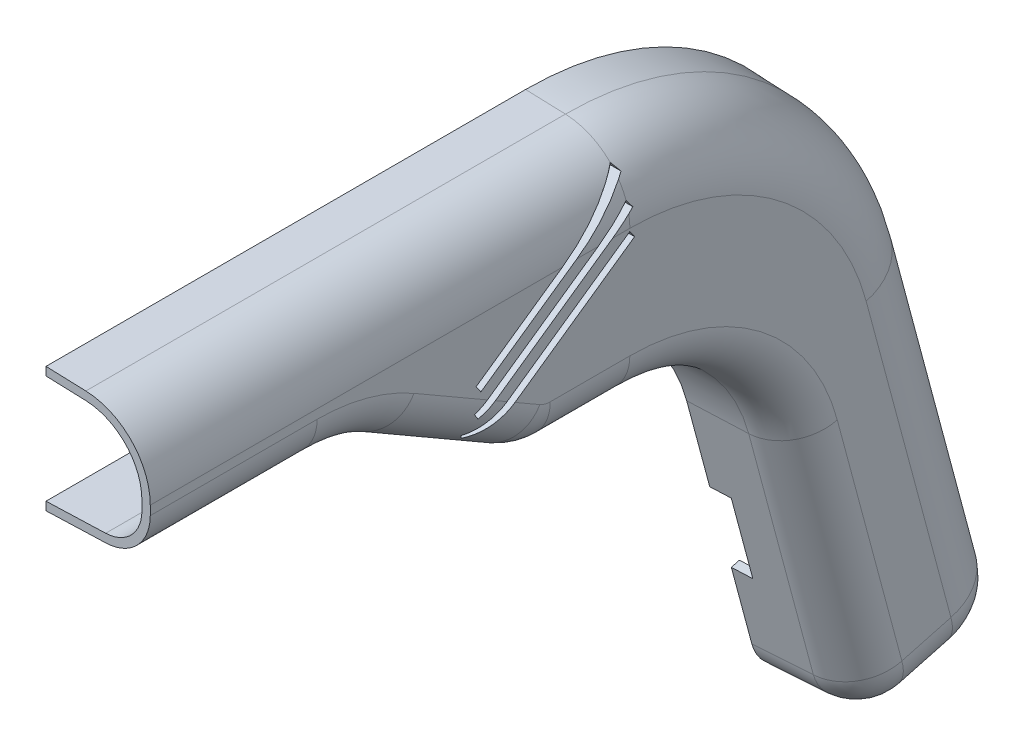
SolidWorks part; units mm, degrees
ref_plane "Front" through (0, 0, 0) normal (0, 0, 1) x (1, 0, 0)
ref_plane "Top" through (0, 0, 0) normal (0, 1, 0) x (1, 0, 0)
ref_plane "Right" through (0, 0, 0) normal (1, 0, 0) x (0, 0, -1)
sketch "Sketch1" plane through (0, 0, 0) normal (1, 0, 0) x (0, 0, -1)
  line L0 (-115, 75) -> (0, 75)
  line L1 (72.4444, 19.4114) -> (95.7382, -67.5219)
  line L2 (95.7382, -67.5219) -> (57.1011, -77.8747)
  line L3 (57.1011, -77.8747) -> (38.637, -8.9658)
  line L4 (0, 20.6815) -> (-23.5009, 20.6815)
  line L5 (-23.5009, 20.6815) -> (-57.5, 40.3109)
  line L6 (-75, 45) -> (-115, 45)
  line L7 (-115, 45) -> (-115, 75)
  line L8 (0, 0) -> (0, -19.3185) construction
  arc A0 (0, 75) -> (72.4444, 19.4114) centre (0, 0) cw
  arc A1 (38.637, -8.9658) -> (0, 20.6815) centre (0, -19.3185) ccw
  arc A2 (-57.5, 40.3109) -> (-75, 45) centre (-75, 10) ccw
  dimension "D1" = 75
  dimension "D5" = 40
  dimension "D8" = 35
  dimension "D2" = 105
  dimension "D3" = 40
  dimension "D4" = 90
  dimension "D6" = 30
  dimension "D7" = 115
  dimension "D9" = 150
  dimension "D10" = 40
extrude "Base-Extrude" add sketch "Sketch1" along normal blind 25
draft "Draft1" type of draft neutral plane draft angle 2 faces to draft 10 parameters "D1"=2
fillet "Fillet1" radius 16 4 edges at (12.5, 21.118, 23.3839) (25, -23.8596, -83.135) (25, 58.8089, -45.1256) (25, 74.127, 57.5)
fillet "Fillet2" radius 11 1 edges at (12.5, -77.34, -57.4098)
fillet "Fillet3" radius 11 11 edges at (25, 44.6507, 65.7154) (25, 32.3819, 42.0205) (25, 13.1082, -24.8819) (25, -37.4633, -47.1767) (25, 21.5545, 9.4912) (25, 22.0993, 23.121) (4.7792, -67.4039, -95.5337) (20.5094, -68.1784, -90.5208) (25, -72.4319, -74.0408) (25, -72.8629, -59.9946) (25, 45.873, 95)
shell "Shell1" thickness 2
ref_plane "Plane1" through (3, 0, 0) normal (-1, 0, 0) x (0, 0, 1)
sketch "Sketch2" plane through (3, 0, 0) normal (-1, 0, 0) x (0, 0, 1)
  line L0 (-10, 27.0009) -> (-10, 67.9199)
  line L1 (40, 36.8882) -> (40, 67.9199)
  line L2 (115, 47.5011) -> (115, 56.4956) construction
  dimension "D1" = 125
  dimension "D2" = 50
rib "Rib1" sketch "Sketch2" sketch "Sketch2" thickness 2 extrusion direction normal to sketch draft on yes draft angle 3 parameters "D1"=2, "D3"=3
ref_plane "Plane2" through (3, 0, 0) normal (-1, 0, 0) x (0, 0, 1)
sketch "Sketch3" plane through (3, 0, 0) normal (-1, 0, 0) x (0, 0, 1)
  line L0 (-92.8929, -56.9032) -> (-72.4444, 19.4114) construction
  line L1 (-67.7198, -75.0294) -> (-85.1194, -70.3672) construction
  circle A0 centre (-86.6981, -49.2387) radius 2.5
  dimension "D1" = 4
  dimension "D2" = 5
  dimension "D3" = 20
extrude "Boss-Extrude1" add sketch "Sketch3" against normal up to next draft 2
fillet "Fillet4" radius 1 31 edges at (19.8277, 24.5742, -8.1181) (19.69, 23.5912, -11.8747) (19.0643, 67.9197, -8.1581) (18.5216, 67.9197, -11.8135) (3, 72.2047, -10.001) (6.2464, 72.243, -8.8299) (8.6485, 21.4487, -11.296) (23, 44.0868, -12.0482) (3, 46.6922, -11) (23, 44.847, -7.9518) (3, 21.582, -10.003) (3, 47.0753, -9) (6.2475, 71.9183, -11.1702) (8.639, 22.0792, -8.7045) (20.4741, 37.3682, 41.9158) (20.4741, 35.1561, 38.0842) (19.0708, 68.4012, 41.8422) (19.0708, 68.4012, 38.1578) (3, 72.894, 40) (6.2443, 72.7807, 41.17) (8.657, 32.1186, 38.7035) (23, 50.4873, 37.9518) (3, 52.4779, 39) (23, 51.6698, 42.0482) (3, 32.639, 40) (3, 53.0552, 41) (6.2443, 72.7807, 38.83) (8.657, 33.6157, 41.2965) (19.5089, -49.9156, -83.697) (4.2388, -50.4446, -88.9372) (7.8117, -46.8267, -87.8387)
sketch "Sketch4" plane through (0, 0, 115) normal (0, 0, 1) x (1, 0, 0)
  line L0 (3, 33.7836) -> (3, 71.9283) construction
  circle A0 centre (3, 58) radius 8.5
  dimension "D2" = 17
  dimension "D1" = 17
extrude "Cut-Extrude1" cut sketch "Sketch4" against normal up to surface (126.4455 mm away)
sketch "Sketch5" plane through (-1.2207, 9.0476, -33.7662) normal (0.0349, -0.2587, 0.9653) x (0.9994, 0.009, -0.0337)
  line L0 (1.2215, -18.6603) -> (1.2215, -79.0067) construction
  line L1 (1.2215, -60) -> (6.2215, -60)
  line L2 (1.2215, -60) -> (1.2215, -40)
  line L3 (1.2215, -40) -> (6.2215, -40)
  line L4 (6.2215, -60) -> (6.2215, -40)
  line L5 (9.1677, -70) -> (-1.9073, -70) construction
  dimension "D1" = 10
  dimension "D2" = 20
  dimension "D3" = 5
extrude "Cut-Extrude2" cut sketch "Sketch5" against normal up to next
hole_wizard "M2.0 (2.000000) Diameter Hole1" positions "Sketch7" profile "Sketch6" hole size "M2.0" standard "Ansi Metric"
sketch "Sketch7" plane through (3, 0, 0) normal (-1, 0, 0) x (0, 0, 1)
  arc A0 (-87.941, -51.4078) -> (-86.6899, -46.7387) centre (-86.6981, -49.2387) ccw construction
  point P0 (-86.6981, -49.2387)
sketch "Sketch6" plane through (3, -49.2387, -86.6981) normal (0, 1, 0) x (0, 0, 1)
  line L0 (0, 0) -> (0, 12.6009)
  line L1 (0, 12.6009) -> (1, 12)
  line L2 (1, 12) -> (1, 0)
  line L5 (1, 0) -> (0, 0)
  line L10 (0, 12.6009) -> (-1, 12) construction
  line L11 (0, -6.35) -> (0, 107.95) construction
  dimension "Hole Dia." = 2
  dimension "Hole Depth" = 12
  dimension "Drill Angle" = 118
sketch "Sketch8" plane through (25, 0, 0) normal (1, 0, 0) x (0, 0, -1)
  line L0 (0, 70) -> (-36.8618, 44.1891)
  line L1 (0, 70) -> (1.1472, 68.3617)
  line L2 (-36.8618, 44.1891) -> (-35.7147, 42.5508)
  line L3 (1.1472, 68.3617) -> (-35.7147, 42.5508)
  line L5 (0, 75) -> (-115, 75) construction
  line L6 (-115, 72.6674) -> (-115, 58.676) construction
  dimension "D1" = 5
  dimension "D2" = 45
  dimension "D3" = 35
  dimension "D4" = 2
  dimension "D5" = 115
extrude "Cut-Extrude3" cut sketch "Sketch8" against normal through all
pattern_linear "LPattern1" count 3 spacing 6 along (0, -1, 0) of "Cut-Extrude3"
